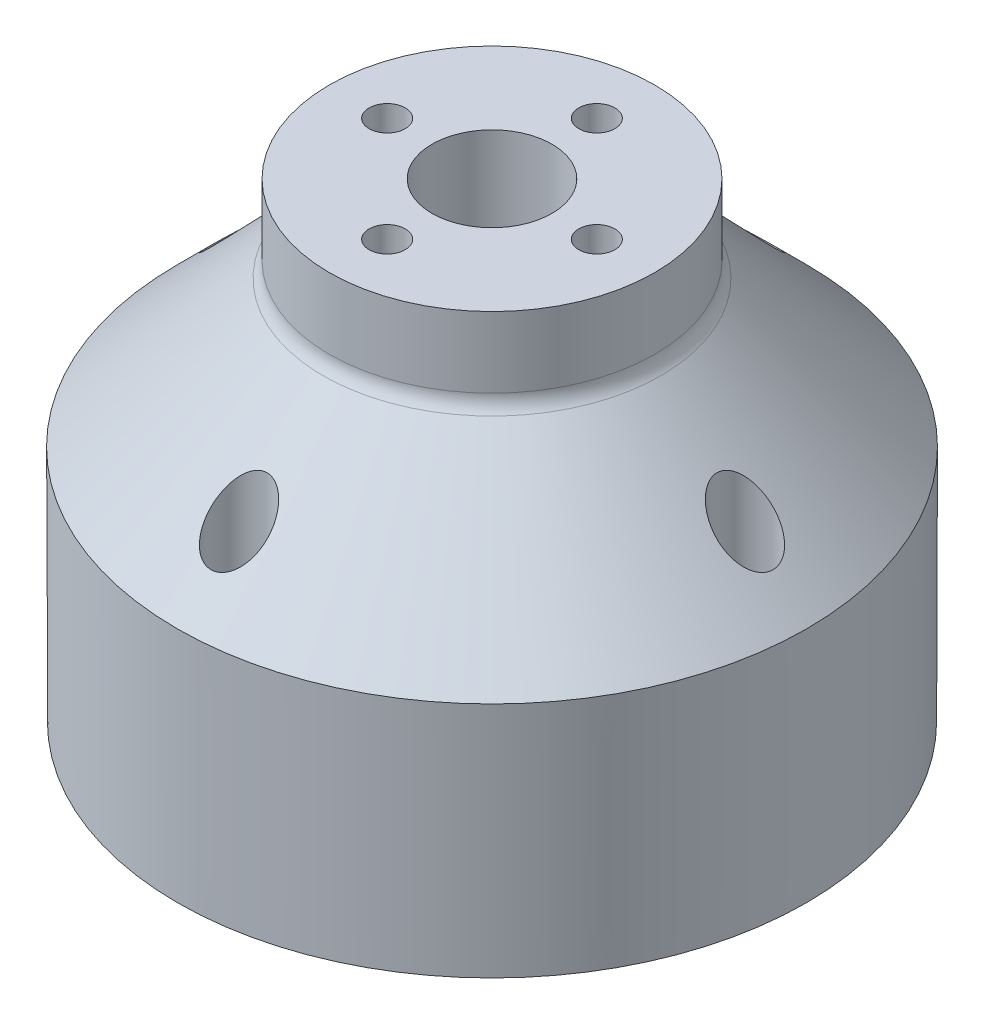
SolidWorks part; units mm, degrees
other "<spur gear_iso>-<Bore>" parameters "D16"=1
ref_plane "Plan de face" through (0, 0, 0) normal (0, 0, 1) x (1, 0, 0)
ref_plane "Plan de dessus" through (0, 0, 0) normal (0, 1, 0) x (1, 0, 0)
ref_plane "Plan de droite" through (0, 0, 0) normal (1, 0, 0) x (0, 0, -1)
sketch "Esquisse1" plane through (0, 0, 0) normal (0, 0, 1) x (1, 0, 0)
  line L0 (0, 0) -> (0, 31.9265) construction
  line L1 (-43.5, 0) -> (-19.75, 0)
  line L2 (-19.75, 0) -> (-19.75, 48.5)
  line L3 (-19.75, 48.5) -> (-20.2, 48.95)
  line L4 (-20.2, 48.95) -> (-20.2, 60.95)
  line L5 (-20.2, 60.95) -> (-42.65, 60.95)
  line L6 (-43.65, 59.95) -> (-43.65, 40.95) construction
  line L7 (-43.65, 40.95) -> (-60, 40.95) construction
  line L8 (-60, 40.95) -> (-60, 37.95) construction
  line L9 (-60, 37.95) -> (-62, 37.95) construction
  line L10 (-62, 37.95) -> (-62, 39.5) construction
  line L11 (-62, 39.5) -> (-43.5, 21) construction
  line L12 (-43.5, 21) -> (-43.5, 0) construction
  line L13 (-42.65, 60.95) -> (-43.65, 59.95)
  line L14 (-43.65, 59.95) -> (-43.5, 0)
  point P9 (-43.65, 60.95)
  dimension "D1" = 43.5
  dimension "D2" = 39.5
  dimension "D3" = 40.4
  dimension "D4" = 48.5
  dimension "D5" = 20
  dimension "D6" = 62
  dimension "D7" = 60
  dimension "D8" = 3
  dimension "D9" = 21
  dimension "D10" = 45
  dimension "D11" = 43.65
  dimension "D12" = 12
  dimension "D13" = 45
  dimension "D14" = 60.95
revolve "Révolution1" add sketch "Esquisse1" angle 360 about L0
sketch "Esquisse3" plane through (0, 0, 0) normal (0, -1, 0) x (1, 0, 0)
  circle A0 centre (0, 35) radius 3.875
  circle A1 centre (35, 0) radius 3.875
  circle A2 centre (0, -35) radius 3.875
  circle A3 centre (-35, 0) radius 3.875
  circle A4 centre (0, 0) radius 19.75
  point P11 (0, 0)
  dimension "D2" = 7.75
  dimension "D3" = 70
  dimension "D1" = 4
chamfer "Chanfrein1" distance 2 angle 45 1 edges at (0, 60.95, -20.2)
chamfer "Chanfrein2" distance 6 angle 45 1 edges at (0, 0, -19.75)
inserted part "spur gear_iso"
move or copy body "Corps-Déplacer/Copier2" placed by mates yes
other "Distance1" parameters "D1"=45
sketch "Esquisse5" plane through (0, 45, 0) normal (0, -1, 0) x (1, 0, 0)
  circle A0 centre (0, 0) radius 43.5
  circle A1 centre (0, 0) radius 20.2
  dimension "D1" = 40.4
extrude "Boss.-Extru.1" add sketch "Esquisse5" against normal blind 16
sketch "Esquisse6" plane through (0, 45, 0) normal (0, -1, 0) x (1, 0, 0)
  circle A0 centre (0, 0) radius 19.75
  dimension "D1" = 39.5
extrude "Enlèv. mat.-Extru.2" cut sketch "Esquisse3" against normal through all both and the other way through all
sketch "Esquisse8" plane through (0, 60.95, 0) normal (0, 1, 0) x (1, 0, 0)
  circle A0 centre (0, 0) radius 20.2
  dimension "D1" = 40.4
chamfer "Chanfrein5" distance 1.5 distance2 1.5 4 edges at (0, 0, 38.875) (-35, 0, 3.875) (0, 0, -31.125) (35, 0, 3.875)
sketch "Esquisse9" plane through (0, 55, 0) normal (0, 1, 0) x (1, 0, 0)
  circle A0 centre (0, 0) radius 20.2
  dimension "D1" = 40.4
extrude "Enlèv. mat.-Extru.6" cut sketch "Esquisse9" against normal blind 12
chamfer "Chanfrein7" distance 1 angle 45 2 edges at (0, 43, 20.2) (0, 43, 19.75)
chamfer "Chanfrein8" distance 1 distance2 1 197 edges at (2.8606, 55, 89.2041) (14.2443, 55, 88.106) (25.3941, 55, 85.5611) (36.1269, 55, 81.6113) (46.2665, 55, 76.3215) (55.6465, 55, 69.7785) (64.1127, 55, 62.0897) (71.5262, 55, 53.3814) (77.7652, 55, 43.7965) (82.7273, 55, 33.4926) (86.3311, 55, 22.6387) (88.5173, 55, 11.413) (89.25, 55, 0) (88.5173, 55, -11.413) (86.3311, 55, -22.6387) (82.7273, 55, -33.4926) (77.7652, 55, -43.7965) (71.5262, 55, -53.3814) (64.1127, 55, -62.0897) (55.6465, 55, -69.7785) (46.2665, 55, -76.3215) (36.1269, 55, -81.6113) (25.3941, 55, -85.5611) (14.2443, 55, -88.106) (2.8606, 55, -89.2041) (-8.5701, 55, -88.8376) (-19.86, 55, -87.0123) (-30.8238, 55, -83.7583) (-41.2815, 55, -79.129) (-51.0614, 55, -73.2004) (-60.0029, 55, -66.0698) (-67.9591, 55, -57.8544) (-74.7994, 55, -48.689) (-80.4115, 55, -38.7241) (-84.7032, 55, -28.1234) (-87.6042, 55, -17.0609) (-89.0666, 55, -5.7183) (-89.0666, 55, 5.7183) (-87.6042, 55, 17.0609) (-84.7032, 55, 28.1234) (-80.4115, 55, 38.7241) (-74.7994, 55, 48.689) (-67.9591, 55, 57.8544) (-60.0029, 55, 66.0698) (-51.0614, 55, 73.2004) (-41.2815, 55, 79.129) (-30.8238, 55, 83.7583) (-19.86, 55, 87.0123) (-8.5701, 55, 88.8376) (-51.0127, 55, 68.4728) (-50.7359, 55, 63.6208) (-55.4047, 55, 64.9703) (-59.35, 55, 61.3873) (-58.455, 55, 56.6105) (-63.258, 55, 57.3519) (-66.7128, 55, 53.2938) (-65.2142, 55, 48.6706) (-70.0727, 55, 48.7918) (-72.9801, 55, 44.3252) (-70.9027, 55, 39.9317) (-75.7368, 55, 39.4305) (-78.0491, 55, 34.6288) (-75.4269, 55, 30.537) (-80.1572, 55, 29.4218) (-81.8366, 55, 24.3638) (-78.7127, 55, 20.6409) (-83.2615, 55, 18.93) (-84.2803, 55, 13.6988) (-80.7059, 55, 10.4059) (-84.9987, 55, 8.1273) (-85.3401, 55, 2.8088) (-81.374, 55, 0) (-85.3401, 55, -2.8088) (69.9902, 55, -48.91) (68.1986, 55, -44.3924) (73.0548, 55, -44.202) (75.6701, 55, -39.5583) (73.3154, 55, -35.3069) (78.1075, 55, -34.4971) (80.1075, 55, -29.5571) (77.2285, 55, -25.6416) (81.8776, 55, -24.2257) (83.2294, 55, -19.0705) (79.8734, 55, -15.5553) (84.3033, 55, -13.5565) (84.9848, 55, -8.2708) (81.2068, 55, -5.2137) (85.3447, 55, -2.6647) (85.3447, 55, 2.6647) (81.2068, 55, 5.2137) (84.9848, 55, 8.2708) (84.3033, 55, 13.5565) (79.8734, 55, 15.5553) (83.2294, 55, 19.0705) (81.8776, 55, 24.2257) (77.2285, 55, 25.6416) (80.1075, 55, 29.5571) (78.1075, 55, 34.4971) (73.3154, 55, 35.3069) (75.6701, 55, 39.5583) (73.0548, 55, 44.202) (68.1986, 55, 44.3924) (69.9902, 55, 48.91) (66.8026, 55, 53.1811) (61.9619, 55, 52.7489) (63.1612, 55, 57.4586) (59.4535, 55, 61.2871) (54.7078, 55, 60.2394) (55.295, 55, 65.0638) (51.1282, 55, 68.3866) (46.5554, 55, 66.7407) (46.5208, 55, 71.6005) (41.9633, 55, 74.3633) (37.6386, 55, 72.1461) (36.9828, 55, 76.9617) (32.1094, 55, 79.1189) (28.1037, 55, 76.3669) (26.8375, 55, 81.0591) (21.7283, 55, 82.5754) (18.1074, 55, 79.3338) (16.2516, 55, 83.8255) (10.9904, 55, 84.6761) (7.8138, 55, 80.998) (5.3988, 55, 85.2155) (0.0721, 55, 85.3863) (-2.6082, 55, 81.3322) (-5.5426, 55, 85.2062) (-10.8475, 55, 84.6945) (-12.9873, 55, 80.3309) (-16.3931, 55, 83.7979) (-21.5889, 55, 82.612) (-23.1531, 55, 78.0106) (-26.9743, 55, 81.0136) (-31.9759, 55, 79.173) (-32.9388, 55, 74.4094) (-37.1126, 55, 76.8991) (-41.8378, 55, 74.434) (-42.1837, 55, 69.5864) (-46.6416, 55, 71.5219) (0, 55, -43.6376) (-84.9987, 55, -8.1273) (-80.7059, 55, -10.4059) (-84.2803, 55, -13.6988) (-83.2615, 55, -18.93) (-78.7127, 55, -20.6409) (-81.8366, 55, -24.3638) (-80.1572, 55, -29.4218) (-75.4269, 55, -30.537) (-78.0491, 55, -34.6288) (-75.7368, 55, -39.4305) (-70.9027, 55, -39.9317) (-72.9801, 55, -44.3252) (-70.0727, 55, -48.7918) (-65.2142, 55, -48.6706) (-66.7128, 55, -53.2938) (-63.258, 55, -57.3519) (-58.455, 55, -56.6105) (-59.35, 55, -61.3873) (-55.4047, 55, -64.9703) (-50.7359, 55, -63.6208) (-51.0127, 55, -68.4728) (-46.6416, 55, -71.5219) (-42.1837, 55, -69.5864) (-41.8378, 55, -74.434) (-37.1126, 55, -76.8991) (-32.9388, 55, -74.4094) (-31.9759, 55, -79.173) (-26.9743, 55, -81.0136) (-23.1531, 55, -78.0106) (-21.5889, 55, -82.612) (-16.3931, 55, -83.7979) (-12.9873, 55, -80.3309) (-10.8475, 55, -84.6945) (-5.5426, 55, -85.2062) (-2.6082, 55, -81.3322) (0.0721, 55, -85.3863) (5.3988, 55, -85.2155) (7.8138, 55, -80.998) (10.9904, 55, -84.6761) (16.2516, 55, -83.8255) (18.1074, 55, -79.3338) (21.7283, 55, -82.5754) (26.8375, 55, -81.0591) (28.1037, 55, -76.3669) (32.1094, 55, -79.1189) (36.9828, 55, -76.9617) (37.6386, 55, -72.1461) (41.9633, 55, -74.3633) (46.5208, 55, -71.6005) (46.5554, 55, -66.7407) (51.1282, 55, -68.3866) (55.295, 55, -65.0638) (54.7078, 55, -60.2394) (59.4535, 55, -61.2871) (63.1612, 55, -57.4586) (61.9619, 55, -52.7489) (66.8026, 55, -53.1811)
sketch "Esquisse10" plane through (0, 45, 0) normal (0, -1, 0) x (1, 0, 0)
  circle A0 centre (0, 0) radius 107.2157
extrude "Enlèv. mat.-Extru.7" cut sketch "Esquisse10" against normal through all
sketch "Esquisse11" plane through (0, 45, 0) normal (0, 1, 0) x (1, 0, 0)
  circle A0 centre (0, 0) radius 43.6126
  circle A1 centre (0, 35) radius 3.875
  circle A2 centre (35, 0) radius 3.875
  circle A3 centre (0, -35) radius 3.875
  circle A4 centre (-35, 0) radius 3.875
  circle A5 centre (0, 0) radius 8.3
  circle A6 centre (0, 14.5) radius 2.5
  circle A7 centre (14.5, 0) radius 2.5
  circle A8 centre (0, -14.5) radius 2.5
  circle A9 centre (-14.5, 0) radius 2.5
  point P15 (0, 0)
  point P25 (0, 0)
  dimension "D2" = 16.6
  dimension "D4" = 29
  dimension "D5" = 5
  dimension "D1" = 4
  dimension "D3" = 4
extrude "Boss.-Extru.2" add sketch "Esquisse11" along normal blind 20
sketch "Esquisse12" plane through (0, 0, 0) normal (1, 0, 0) x (0, 0, -1)
  line L0 (0, 0) -> (0, 75.1937) construction
  line L1 (-43.5823, 32.8889) -> (-22.5, 53.9712)
  line L2 (-43.6126, 45) -> (-43.5, 0) construction
  line L3 (-22.5, 53.9712) -> (-22.5, 65)
  line L4 (43.6126, 65) -> (-43.6126, 65) construction
  arc A0 (-43.5823, 32.8889) -> (-22.5, 65) centre (-49.0967, 59.4856) cw
  dimension "D1" = 45
  dimension "D2" = 45
revolve "Enlèvement de matière-Révolution1" cut sketch "Esquisse12" angle 360 about L0
fillet "Congé1" radius 3 1 edges at (0, 53.9712, -22.5)
